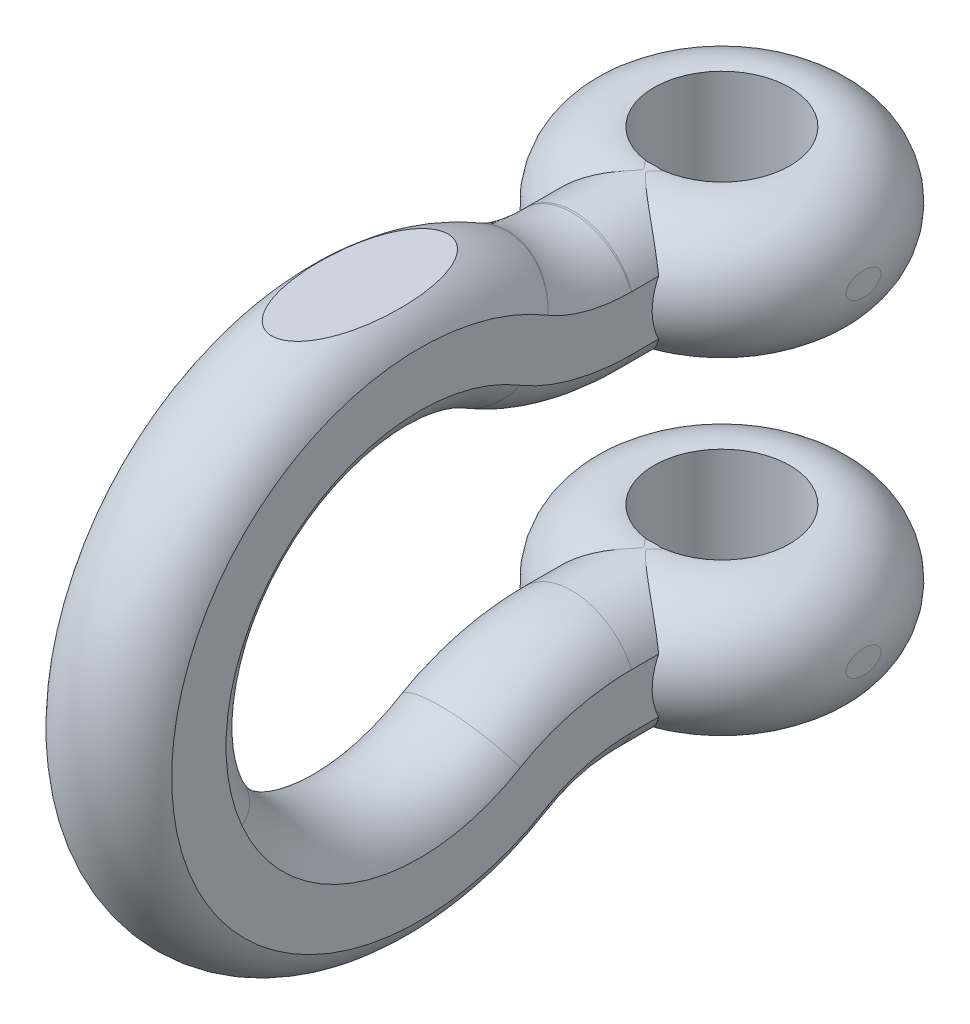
SolidWorks part; units mm, degrees
ref_plane "Face" through (0, 0, 0) normal (0, 0, 1) x (1, 0, 0)
ref_plane "Dessus" through (0, 0, 0) normal (0, 1, 0) x (1, 0, 0)
ref_plane "Droite" through (0, 0, 0) normal (1, 0, 0) x (0, 0, -1)
imported_body "bolt_type_anchor_shackles_1019533"
sketch "Sketch1" plane through (0, 0, 0) normal (0, 0, 1) x (1, 0, 0)
  line L1 (-65.222, 14.2875) -> (65.222, 14.2875)
  line L2 (-65.222, 14.2875) -> (-65.222, -14.2875)
  line L3 (-65.222, -14.2875) -> (65.222, -14.2875)
  line L4 (65.222, 14.2875) -> (65.222, -14.2875)
  line L5 (-65.222, 14.2875) -> (65.222, -14.2875) construction
  line L6 (-65.222, -14.2875) -> (65.222, 14.2875) construction
  point P0 (0, 0)
  dimension "D1" = 28.575
sketch "Sketch2" plane through (11.2, 0, 0) normal (1, 0, 0) x (0, 0, -1)
  line L0 (-28.0735, 35.6964) -> (-28.0735, -35.6964)
  line L1 (-28.0735, -35.6964) -> (-28.0735, -65.9656)
  line L2 (-43.7067, 39.6966) -> (-67.331, 0)
  line L4 (-28.0735, 35.6964) -> (-28.0735, 65.9656)
  line L5 (-67.331, 0) -> (-43.7067, -39.6966)
  line L6 (-43.7067, -39.6966) -> (-28.0735, -65.9656)
  line L8 (-43.7067, 39.6966) -> (-28.0735, 65.9656)
  point P11 (0, 0)
extrude "Cut-Extrude1" cut sketch "Sketch2" against normal blind 40
loft "Loft1" add
loft "Loft2" add
